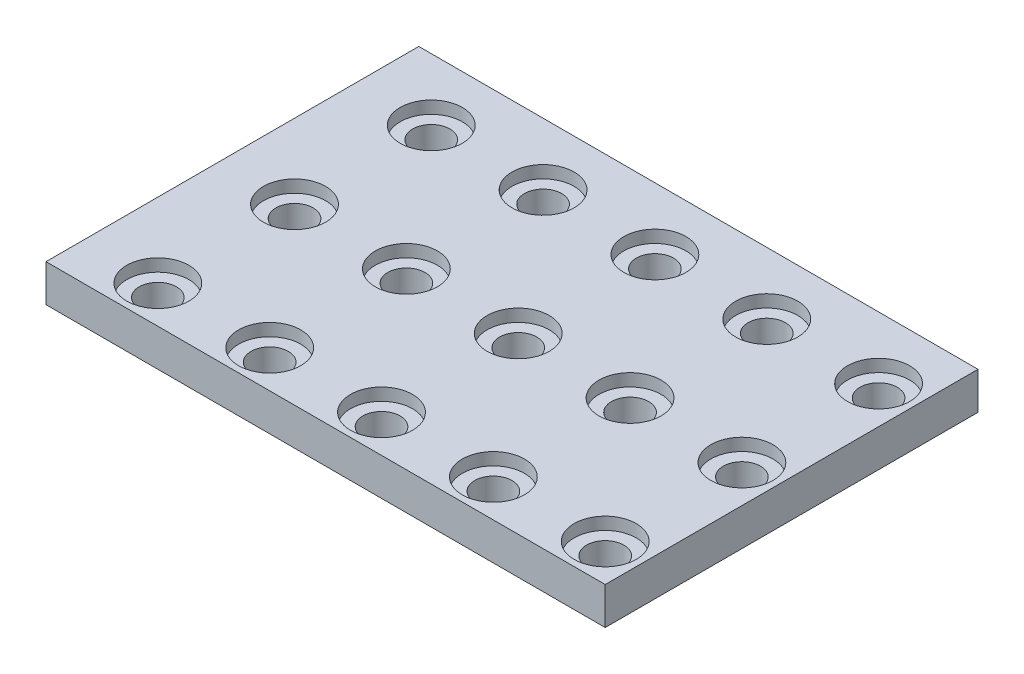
SolidWorks part; units mm, degrees
ref_plane "Front Plane" through (0, 0, 0) normal (0, 0, 1) x (1, 0, 0)
ref_plane "Top Plane" through (0, 0, 0) normal (0, 1, 0) x (1, 0, 0)
ref_plane "Right Plane" through (0, 0, 0) normal (1, 0, 0) x (0, 0, -1)
sketch "Sketch1" plane through (0, 0, 0) normal (0, 1, 0) x (1, 0, 0)
  line L1 (0, 0) -> (45, 0)
  line L2 (0, 0) -> (0, -30)
  line L3 (0, -30) -> (45, -30)
  line L4 (45, 0) -> (45, -30)
  dimension "D1" = 45
  dimension "D2" = 30
extrude "Extrude1" add sketch "Sketch1" along normal blind 3
sketch "Sketch7" plane through (0, 3, 0) normal (0, 1, 0) x (-1, 0, 0)
  line L0 (-45, 30) -> (-45, 0) construction
  line L1 (0, 30) -> (-45, 30) construction
  circle A0 centre (-42, 27) radius 1.5
  dimension "D1" = 3
  dimension "D2" = 3
  dimension "D3" = 3
extrude "Cut-Extrude3" cut sketch "Sketch7" against normal through all
sketch "Sketch8" plane through (0, 3, 0) normal (0, 1, 0) x (-1, 0, 0)
  circle A2 centre (-42, 27) radius 2.5
  circle A3 centre (-42, 27) radius 2.5
  dimension "D1" = 1
extrude "Cut-Extrude4" cut sketch "Sketch8" against normal blind 1
pattern_linear "LPattern2" count 5 spacing 9 along (-1, 0, 0) count 3 spacing 11 along (0, 0, -1) of "Cut-Extrude3", "Cut-Extrude4"
